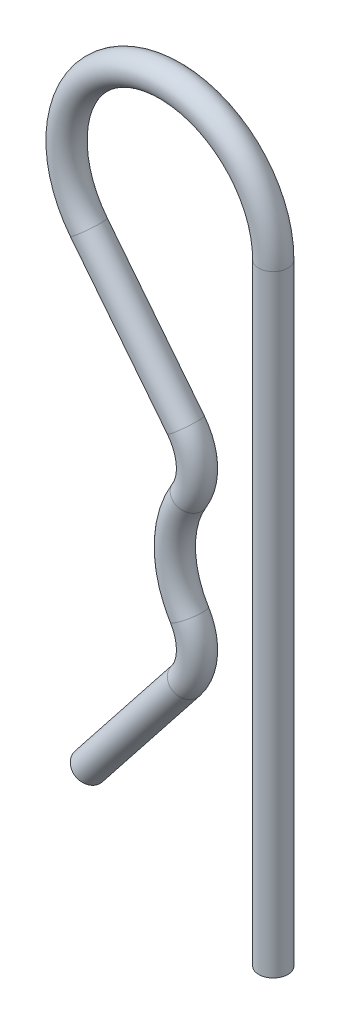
SolidWorks part; units mm, degrees
ref_plane "Plan1" through (0, 0, 0) normal (0, 0, 1) x (1, 0, 0)
ref_plane "Plan2" through (0, 0, 0) normal (0, 1, 0) x (1, 0, 0)
ref_plane "Plan3" through (0, 0, 0) normal (1, 0, 0) x (0, 0, -1)
sketch "Esquisse1" plane through (0, 0, 0) normal (0, 0, 1) x (1, 0, 0)
  line L0 (0, 0) -> (0, 34.4) construction
  line L1 (-15.169, 19.1953) -> (-7.1895, 9.0978) construction
  line L2 (0, 0) -> (-34.4, 0) construction
  line L4 (0, 24.4655) -> (0, 0) construction
  line L5 (0, 0) -> (0, -25.8345) construction
  line L6 (-8.5, 32.9655) -> (0, 32.9655) construction
  line L7 (-15.169, -19.1953) -> (-7.1895, -9.0978) construction
  circle A0 centre (0, 0) radius 34.4 construction
  arc A1 (0, 24.4655) -> (-15.169, 19.1953) centre (-8.5, 24.4655) ccw construction
  arc A2 (-6.9024, 4.2387) -> (-6.9024, -4.2387) centre (0, 0) ccw construction
  arc A3 (-7.1895, 9.0978) -> (-6.9024, 4.2387) centre (-10.524, 6.4628) cw construction
  arc A5 (-6.9024, -4.2387) -> (-7.1895, -9.0978) centre (-10.524, -6.4628) cw
  dimension "D1" = 68.8
  dimension "D2" = 17
  dimension "D3" = 16.2
  dimension "D7" = 4.25
  dimension "D4" = 4.25
  dimension "D6" = 58.8
sketch "Esquisse4" plane through (0, 0, 0) normal (0, 0, 1) x (1, 0, 0)
  line L7 (0, -25.8345) -> (0, 24.4655)
  line L8 (-15.169, 19.1953) -> (-7.1895, 9.0978) construction
  line L9 (-15.169, 19.1953) -> (-7.1895, 9.0978)
  line L10 (-15.169, -19.1953) -> (-7.1895, -9.0978) construction
  line L11 (-15.169, -19.1953) -> (-7.1895, -9.0978)
  arc A7 (0, 24.4655) -> (-15.169, 19.1953) centre (-8.5, 24.4655) ccw construction
  arc A8 (0, 24.4655) -> (-15.169, 19.1953) centre (-8.5, 24.4655) ccw
  arc A9 (-7.1895, -9.0978) -> (-6.9024, -4.2387) centre (-10.524, -6.4628) ccw construction
  arc A10 (-6.9024, 4.2387) -> (-6.9024, -4.2387) centre (0, 0) ccw construction
  arc A11 (-6.9024, 4.2387) -> (-7.1895, 9.0978) centre (-10.524, 6.4628) ccw construction
  arc A12 (-7.1895, -9.0978) -> (-6.9024, -4.2387) centre (-10.524, -6.4628) ccw
  arc A13 (-6.9024, 4.2387) -> (-6.9024, -4.2387) centre (0, 0) ccw
  arc A14 (-6.9024, 4.2387) -> (-7.1895, 9.0978) centre (-10.524, 6.4628) ccw
ref_plane "Plan5" through (0, -25.8345, 0) normal (0, 1, 0) x (-1, 0, 0)
sketch "Esquisse2" plane through (0, -25.8345, 0) normal (0, 1, 0) x (1, 0, 0)
  circle A0 centre (0, 0) radius 1.2
  dimension "D1" = 2.4
sweep "Base-Balayage" add profiles "Esquisse2" path "Esquisse4"
equation "\"D7@Esquisse1\"=\"D2@Esquisse1\"/4"
equation "\"D4@Esquisse1\"=\"D7@Esquisse1\""
